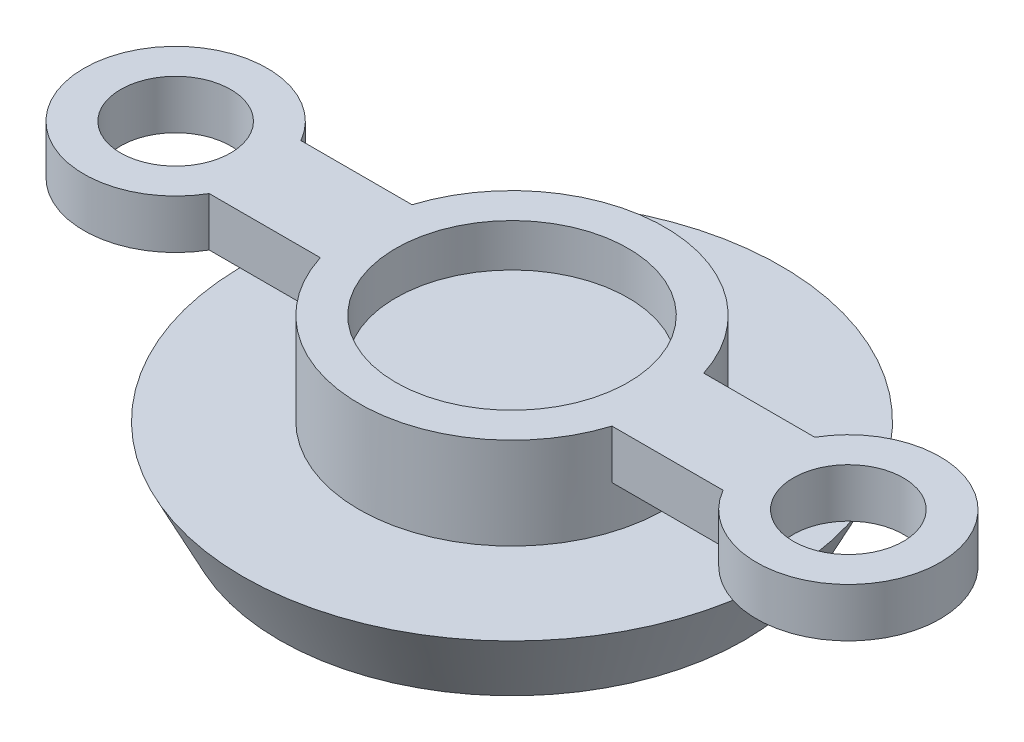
SolidWorks part; units mm, degrees
other "<拾色手电主体（1）>-<凸台-拉伸6>"
ref_plane "前视基准面" through (0, 0, 0) normal (0, 0, 1) x (1, 0, 0)
ref_plane "上视基准面" through (0, 0, 0) normal (0, 1, 0) x (1, 0, 0)
ref_plane "右视基准面" through (0, 0, 0) normal (1, 0, 0) x (0, 0, -1)
inserted part "拾色手电主体（1）"
sketch "草图2" plane through (0, 0, 0) normal (0, -1, 0) x (1, 0, 0)
  circle A0 centre (0, -5.75) radius 4.75 construction
  circle A1 centre (0, -5.75) radius 4 construction
  circle A2 centre (0, -5.75) radius 4.75 construction
  circle A3 centre (0, -5.75) radius 4 construction
  circle A4 centre (0, -5.75) radius 4.55
  dimension "D1" = 0.2
ref_plane "基准面2" through (0, -1.5, 0) normal (0, -1, 0) x (-1, 0, 0)
sketch "草图3" plane through (0, -1.5, 0) normal (0, -1, 0) x (-1, 0, 0)
  circle A2 centre (0, 5.75) radius 3.8
  circle A3 centre (0, 5.75) radius 3.8
  dimension "D1" = 0.2
loft "放样2" add profiles "草图2", "草图3"
sketch "草图11" plane through (0, 0, 0) normal (0, -1, 0) x (1, 0, 0)
  circle A0 centre (5.5, -5.75) radius 0.75 construction
  circle A1 centre (-5.5, -5.75) radius 0.75 construction
  circle A2 centre (5.5, -5.75) radius 0.75 construction
  circle A3 centre (-5.5, -5.75) radius 0.75 construction
sketch "草图4" plane through (0, 0, 0) normal (0, -1, 0) x (1, 0, 0)
  line L1 (-20.1654, 21.2065) -> (19.9463, 21.2065)
  line L2 (-20.1654, 21.2065) -> (-20.1654, -19.3436)
  line L3 (-20.1654, -19.3436) -> (19.9463, -19.3436)
  line L4 (19.9463, 21.2065) -> (19.9463, -19.3436)
extrude "切除-拉伸1" cut sketch "草图4" against normal blind 17
sketch "草图7" plane through (0, 0, 0) normal (0, 1, 0) x (1, 0, 0)
  line L1 (-7.505, 13.8667) -> (7.505, 13.8667)
  line L2 (-7.505, 13.8667) -> (-7.505, -0.8667)
  line L3 (-7.505, -0.8667) -> (7.505, -0.8667)
  line L4 (7.505, 13.8667) -> (7.505, -0.8667)
  line L5 (-7.505, 13.8667) -> (7.505, -0.8667) construction
  line L6 (-7.505, -0.8667) -> (7.505, 13.8667) construction
  point P0 (0, 6.5)
extrude "切除-拉伸2" cut sketch "草图7" against normal blind 0.3
sketch "草图8" plane through (0, -0.3, 0) normal (0, 1, 0) x (1, 0, 0)
  circle A0 centre (0, 5.75) radius 1.9
  dimension "D1" = 3.8
extrude "凸台-拉伸1" add sketch "草图8" along normal blind 0.8
sketch "草图9" plane through (0, -0.3, 0) normal (0, 1, 0) x (1, 0, 0)
  circle A0 centre (0, 5.75) radius 1.9
  circle A1 centre (0, 5.75) radius 2.5
  dimension "D1" = 3.8
  dimension "D2" = 5
extrude "凸台-拉伸2" add sketch "草图9" along normal blind 1.5
sketch "草图13" plane through (0, 1.2, 0) normal (0, 1, 0) x (1, 0, 0)
  line L0 (-5.5, 6.5) -> (-5.5, 5) construction
  line L1 (-5.5, 6.5) -> (0, 6.5) construction
  line L2 (-5.5, 5) -> (0, 5) construction
  line L3 (0, 6.5) -> (0, 5) construction
  line L4 (-4.201, 6.5) -> (-2.3848, 6.5)
  line L5 (-4.201, 5) -> (-2.3848, 5)
  circle A0 centre (-5.5, 5.75) radius 1.5
  circle A1 centre (5.5, 5.75) radius 1.5 construction
  circle A2 centre (-5.5, 5.75) radius 0.9
  circle A3 centre (5.5, 5.75) radius 0.9 construction
  circle A4 centre (0, 5.75) radius 2.5 construction
  arc A5 (-2.3848, 6.5) -> (-2.3848, 5) centre (0, 5.75) ccw
  point P11 (0, 5.75)
  dimension "D1" = 1.8
  dimension "D2" = 3
  dimension "D3" = 1.5
extrude "凸台-拉伸3" add sketch "草图13" against normal blind 0.8 contours A0 A2 | A0 L5 L4 M9
mirror "镜向1" about plane through (0, 0, 0) normal (1, 0, 0) of "凸台-拉伸3"
